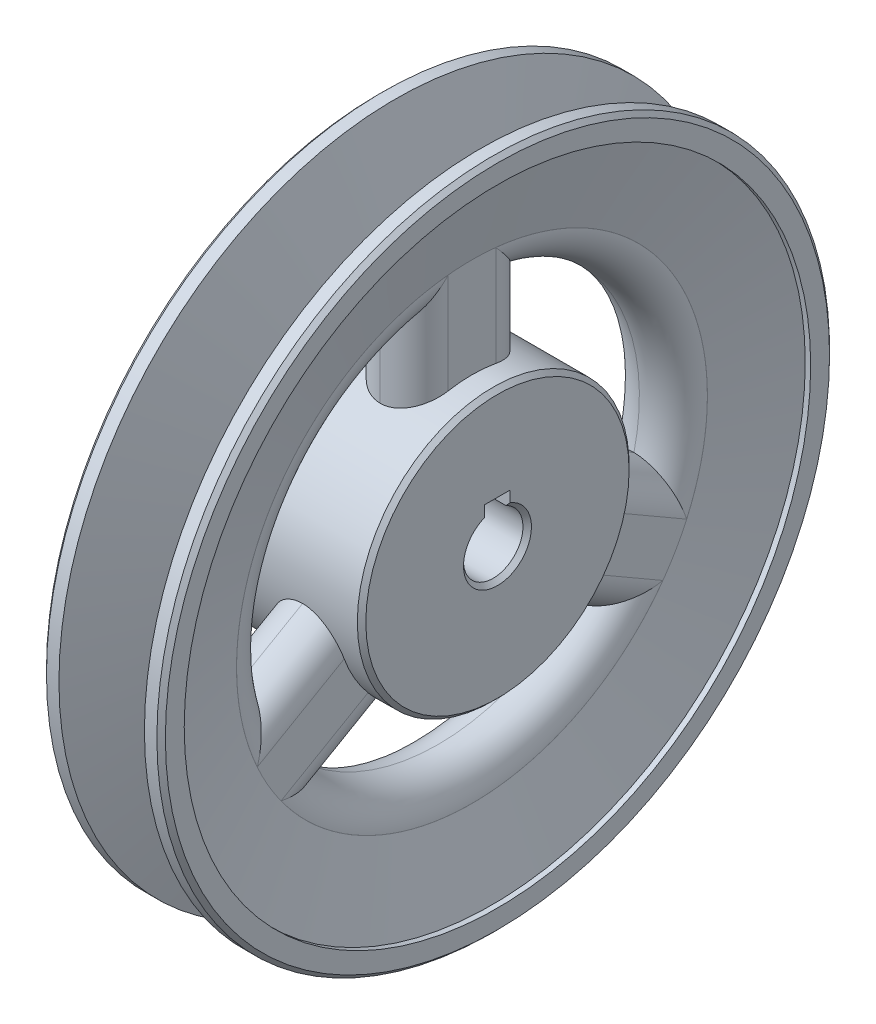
SolidWorks part; units mm, degrees
ref_plane "Front Plane" through (0, 0, 0) normal (0, 0, 1) x (1, 0, 0)
ref_plane "Top Plane" through (0, 0, 0) normal (0, 1, 0) x (1, 0, 0)
ref_plane "Right Plane" through (0, 0, 0) normal (1, 0, 0) x (0, 0, -1)
sketch "Sketch1" plane through (0, 0, 0) normal (0, 0, 1) x (1, 0, 0)
  line L0 (-19.05, 23.7998) -> (-19.05, 5.5562)
  line L1 (-19.05, 5.5562) -> (19.05, 5.5562)
  line L2 (19.05, 5.5562) -> (19.05, 62.0712)
  line L3 (19.05, 62.0712) -> (18.2563, 62.865)
  line L4 (18.2563, 62.865) -> (15.9258, 62.865)
  line L5 (15.9258, 62.865) -> (11.0335, 46.863)
  line L6 (11.0335, 46.863) -> (4.8415, 46.863)
  line L7 (4.8415, 46.863) -> (-0.0508, 62.865)
  line L8 (-0.0508, 62.865) -> (-2.3812, 62.865)
  line L9 (-2.3812, 62.865) -> (-3.175, 62.0712)
  line L10 (-3.175, 62.0712) -> (-3.175, 25.527)
  line L11 (-3.302, 25.4) -> (-17.4498, 25.4)
  line L13 (-34.6357, 0) -> (36.1964, 0) construction
  line L14 (0, 0) -> (0, 5.5562) construction
  line L15 (7.9375, 46.863) -> (7.9375, 31.5479) construction
  line L16 (19.05, 62.0712) -> (-3.175, 62.0712) construction
  arc A0 (-3.175, 25.527) -> (-3.302, 25.4) centre (-3.302, 25.527) cw
  arc A1 (-17.4498, 25.4) -> (-19.05, 23.7998) centre (-17.4498, 23.7998) ccw
  dimension "D1" = 107
  dimension "D2" = 5.5562
  dimension "L" = 38.1
  dimension "Diameter" = 50.8
  dimension "Pulley Diameter" = 93.726
  dimension "Outside Diameter" = 125.73
  dimension "D5" = 11.1125
  dimension "D6" = 107
  dimension "Pulley Length" = 22.225
  dimension "D9" = 45
  dimension "Chamfer Diameter Upper" = 124.1425
  dimension "Fillet Diameter" = 51.054
  dimension "Pulley Thickness" = 3.1242
  dimension "Fillet Lower" = 47.5996
revolve "Edit hole here" add sketch "Sketch1" angle 360 about L13
sketch "Sketch2" plane through (0, 0, 0) normal (0, 0, 1) x (1, 0, 0)
  line L0 (-11.176, 25.4) -> (-7.2073, 25.4)
  line L1 (-7.2073, 25.4) -> (-7.9756, 24.6317)
  line L2 (-7.9756, 24.6317) -> (-7.9756, 5.0546)
  line L3 (-7.9756, 5.0546) -> (-7.2073, 4.2863)
  line L4 (-7.2073, 4.2863) -> (-11.176, 4.2863)
  line L5 (-11.176, 4.2863) -> (-11.176, 25.4)
  line L6 (-11.176, 4.2863) -> (-11.176, 25.4) construction
  line L7 (-3.302, 25.4) -> (-17.4498, 25.4) construction
  line L9 (-11.176, 25.4) -> (-11.176, 32.0533) construction
  line L10 (-19.05, 23.7998) -> (-19.05, -23.7998) construction
  line L11 (19.05, 5.5562) -> (-19.05, 5.5562) construction
  dimension "D1" = 45
  dimension "D2" = 1.27
  dimension "Chamfer Height" = 0.7684
  dimension "Hole Location" = 7.874
  dimension "Hole Diameter" = 6.4008
  dimension "D6" = 45
revolve "Cut-Revolve1" cut sketch "Sketch2" angle 360 about L5
pattern_circular "CirPattern1" count 2 every 90 of "Cut-Revolve1"
sketch "Sketch4" plane through (0, 0, 0) normal (0, 0, 1) x (1, 0, 0)
  line L0 (-11.176, 25.4) -> (-14.3764, 25.4)
  line L1 (-11.176, 25.2566) -> (-11.176, 24.6317) construction
  line L2 (-14.3764, 25.4) -> (-15.1448, 24.6316)
  line L3 (-15.1448, 24.6316) -> (-15.1448, 16.6433)
  line L4 (-15.1448, 16.6433) -> (-14.3764, 15.875)
  line L5 (-14.3764, 15.875) -> (-11.176, 15.875)
  line L6 (-11.176, 24.6317) -> (-11.176, 5.0546) construction
  line L7 (-11.176, 15.875) -> (-11.176, 25.4)
  line L8 (-11.176, 25.4) -> (-11.176, 23.5347) construction
  dimension "Chamfer Diameter" = 6.4008
  dimension "Plug Diameter" = 7.9375
  dimension "D3" = 45
  dimension "Plug Length" = 9.525
revolve "Revolve2" add sketch "Sketch4" angle 360 about L8
sketch "Sketch5" plane through (0, 0, 0) normal (0, 0, 1) x (1, 0, 0)
  line L0 (-11.176, 25.4) -> (-11.176, 20.2921)
  line L1 (-7.9756, 25.4) -> (-14.3764, 25.4) construction
  line L2 (-11.176, 24.6316) -> (-11.176, 25.4) construction
  line L3 (-11.176, 25.2566) -> (-11.176, 24.6317) construction
  line L4 (-11.176, 20.2921) -> (-13.1604, 21.4377)
  line L5 (-13.1604, 21.4377) -> (-13.1604, 25.4)
  line L6 (-13.1604, 25.4) -> (-11.176, 25.4)
  line L7 (-11.176, 25.4) -> (-11.176, 23.8009) construction
  dimension "Bore Diameter" = 3.9688
  dimension "D2" = 60
  dimension "Bore Length" = 5.1079
revolve "Cut-Revolve3" cut sketch "Sketch5" angle 360 about L7
sketch "Sketch6" plane through (0, 25.4, 0) normal (0, 1, 0) x (1, 0, 0)
  line L1 (-11.176, 2.2914) -> (-13.1604, 1.1457)
  line L2 (-13.1604, 1.1457) -> (-13.1604, -1.1457)
  line L3 (-13.1604, -1.1457) -> (-11.176, -2.2914)
  line L4 (-11.176, -2.2914) -> (-9.1916, -1.1457)
  line L5 (-9.1916, -1.1457) -> (-9.1916, 1.1457)
  line L6 (-9.1916, 1.1457) -> (-11.176, 2.2914)
  circle A0 centre (-11.176, 0) radius 1.9844 construction
  dimension "Width Across Flats" = 3.9688
extrude "Extrude1" cut sketch "Sketch6" against normal blind 3.9624
pattern_circular "CirPattern2" count 2 every 90 about axis through (0, 0, 0) along (1, 0, 0)
sketch "Sketch7" plane through (-19.05, 0, 0) normal (-1, 0, 0) x (0, 0, 1)
  line L0 (0, 5.5562) -> (2.3812, 5.5562) construction
  line L1 (0, 0) -> (0, 7.9375) construction
  line L2 (-2.3813, 5.0201) -> (-2.3813, 7.9375)
  line L3 (-2.3813, 7.9375) -> (2.3812, 7.9375)
  line L4 (2.3813, 5.0201) -> (2.3812, 7.9375)
  arc A0 (2.3813, 5.0201) -> (-2.3813, 5.0201) centre (0, 0) ccw
  circle A1 centre (0, 0) radius 5.5562 construction
  dimension "Keyway Height" = 2.3813
  dimension "Keyway Width" = 4.7625
sketch "Sketch8" plane through (0, 0, 0) normal (0, 0, 1) x (1, 0, 0)
  line L0 (19.05, 58.547) -> (18.034, 58.547)
  line L3 (19.05, -62.0712) -> (19.05, 62.0712) construction
  line L4 (18.034, 58.547) -> (14.2875, 44.0055)
  line L5 (14.2875, 44.0055) -> (14.2875, 25.4)
  line L6 (14.2875, 25.4) -> (19.05, 25.4)
  line L7 (19.05, 25.4) -> (19.05, 58.547)
  line L8 (-3.302, 25.4) -> (-7.2072, 25.4) construction
  line L9 (-19.05, 23.7998) -> (-19.05, -23.7998) construction
  line L10 (0, 0) -> (33.5283, 0) construction
  line L11 (7.9375, 46.863) -> (7.9375, 0) construction
  line L12 (11.0335, 46.863) -> (4.8415, 46.863) construction
  line L13 (-3.175, 25.527) -> (-3.175, 58.547)
  line L14 (-3.302, 25.4) -> (1.5875, 25.4)
  line L15 (1.5875, 44.0055) -> (1.5875, 25.4)
  line L16 (-2.159, 58.547) -> (1.5875, 44.0055)
  line L17 (-3.175, 58.547) -> (-2.159, 58.547)
  line L19 (-3.175, 62.0712) -> (-3.175, -62.0712) construction
  arc A0 (-3.302, 25.4) -> (-3.175, 25.527) centre (-3.302, 25.527) ccw
  arc A1 (-3.302, 25.4) -> (-3.175, 25.527) centre (-3.302, 25.527) ccw construction
  dimension "D1" = 33.3375
  dimension "D2" = 1.016
  dimension "D3" = 117.094
  dimension "D4" = 88.011
revolve "Cut-Revolve4" cut sketch "Sketch8" angle 360 about L10
sketch "Sketch9" plane through (-3.175, 0, 0) normal (-1, 0, 0) x (0, 0, 1)
  line L0 (-10.795, 36.0617) -> (-10.795, 22.9919)
  line L1 (0, 0) -> (0, 68.2657) construction
  line L2 (10.795, 36.0617) -> (10.795, 22.9919)
  line L3 (0, 0) -> (-63.7639, 36.8141) construction
  line L4 (-25.8329, -27.3796) -> (-14.5141, -20.8447)
  line L5 (-36.6279, -8.6821) -> (-25.3091, -2.1472)
  line L6 (36.6279, -8.6821) -> (25.3091, -2.1472)
  line L7 (25.8329, -27.3796) -> (14.5141, -20.8447)
  arc A0 (-10.795, 22.9919) -> (-25.3091, -2.1472) centre (0, 0) ccw
  arc A1 (-10.795, 36.0617) -> (-36.6279, -8.6821) centre (0, 0) ccw
  circle A2 centre (0, 0) radius 25.4 construction
  arc A3 (36.6279, -8.6821) -> (10.795, 36.0617) centre (0, 0) ccw
  arc A4 (25.3091, -2.1472) -> (10.795, 22.9919) centre (0, 0) ccw
  arc A5 (-14.5141, -20.8447) -> (14.5141, -20.8447) centre (0, 0) ccw
  arc A6 (-25.8329, -27.3796) -> (25.8329, -27.3796) centre (0, 0) ccw
  dimension "D1" = 75.2856
  dimension "D2" = 21.59
  dimension "D3" = 60
extrude "Extrude3" cut sketch "Sketch9" against normal through all
fillet "Fillet1" radius 6.35 12 edges at (14.2875, -24.1122, -20.1735) (1.5875, -24.1122, -20.1735) (14.2875, -24.1122, 20.1735) (1.5875, -24.1122, 20.1735) (14.2875, -5.4147, 30.9685) (1.5875, -5.4147, 30.9685) (14.2875, -5.4147, -30.9685) (1.5875, -5.4147, -30.9685) (14.2875, 29.5268, -10.795) (1.5875, 29.5268, -10.795) (14.2875, 29.5268, 10.795) (1.5875, 29.5268, 10.795)
fillet "Fillet2" radius 6.35 6 edges at (14.2875, -37.6428, 0) (1.5875, -37.6428, 0) (14.2875, 18.8214, 32.5996) (1.5875, 18.8214, 32.5996) (14.2875, 18.8214, -32.5996) (1.5875, 18.8214, -32.5996)
chamfer "Chamfer1" distance 0.7937 angle 45 1 edges at (19.05, 0, 25.4)
chamfer "Chamfer3" distance 0.7937 angle 45 2 edges at (19.05, 0, 5.5562) (-19.05, 0, 5.5562)
extrude "Key" cut sketch "Sketch7" against normal through all
equation "\"D5@Sketch1\" = \"Pulley Length@Sketch1\" / 2"
